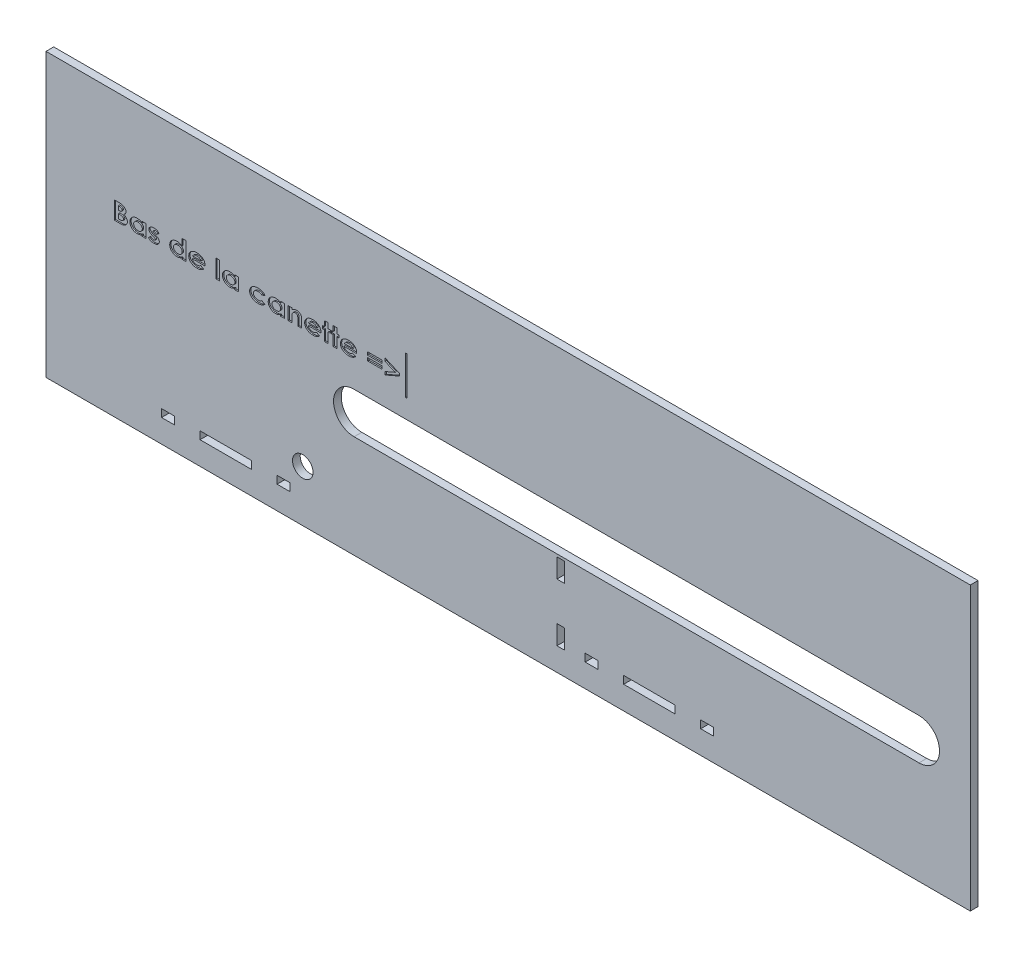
SolidWorks part; units mm, degrees
ref_plane "Plan de face" through (0, 0, 0) normal (0, 0, 1) x (1, 0, 0)
ref_plane "Plan de dessus" through (0, 0, 0) normal (0, 1, 0) x (1, 0, 0)
ref_plane "Plan de droite" through (0, 0, 0) normal (1, 0, 0) x (0, 0, -1)
sketch "Esquisse1" plane through (0, 0, 0) normal (0, 0, 1) x (1, 0, 0)
  line L0 (20, 28) -> (240, 28) construction
  line L1 (20, 36) -> (240, 36)
  line L2 (20, 20) -> (240, 20)
  line L4 (-100, -30) -> (260, -30)
  line L5 (-100, -30) -> (-100, 90)
  line L6 (-100, 90) -> (260, 90)
  line L7 (260, -30) -> (260, 90)
  circle A0 centre (0, 0) radius 4
  arc A1 (20, 36) -> (20, 20) centre (20, 28) ccw
  arc A2 (240, 20) -> (240, 36) centre (240, 28) ccw
  point P5 (130, 28)
  point P10 (130, 20)
  dimension "D1" = 8
  dimension "D2" = 16
  dimension "D3" = 220
  dimension "D4" = 20
  dimension "D5" = 28
  dimension "D6" = 100
  dimension "D7" = 30
  dimension "D8" = 120
  dimension "D9" = 360
extrude "Boss.-Extru.1" add sketch "Esquisse1" along normal blind 3
other "Empreinte1"
other "butee<1>@Assemblage11"
other "Empreinte2"
other "butee<2>@Assemblage11"
sketch "Esquisse2" plane through (0, 0, 3) normal (0, 0, 1) x (1, 0, 0)
  line L0 (40.28, 58.2901) -> (40.28, 43.2901)
  line L6 (260, -30) -> (260, 90) construction
  dimension "D1" = 219.72
  dimension "D2" = 15
extrude "Enlèv. de mat.-Extru.-Mince1" cut sketch "Esquisse2" against normal blind 1 and the other way through all thin
other "Empreinte3"
other "guide<1>@Assemblage11"
sketch "Esquisse3" plane through (0, 0, 3) normal (0, 0, 1) x (1, 0, 0)
  line L0 (-20.5623, 51.5712) -> (36.7637, 51.5712) construction
  text T0 "<b>Bas de la canette =></b>" font "Century Gothic" height in points 26
  point P3 (81.6207, 68.5133)
  point P4 (74.062, 71.9931)
  point P5 (7.7282, 69.9582)
  point P6 (36.7637, 53.8837)
  point P7 (-12.9085, 51.7083)
  point P8 (-24.9864, 52.3321)
  point P9 (-15.8664, 51.4903)
  point P10 (-20.5623, 51.5712)
extrude "Enlèv. mat.-Extru.1" cut sketch "Esquisse3" against normal blind 0.5
sketch "Esquisse4" plane through (0, -30, 0) normal (0, -1, 0) x (1, 0, 0)
  line L5 (-100, 0) -> (260, 0)
  line L6 (260, 0) -> (260, 3)
  line L7 (260, 3) -> (-100, 3)
  line L8 (-100, 3) -> (-100, 0)
  line L9 (-100, 0) -> (260, 0)
  line L10 (260, 0) -> (260, 3)
  line L11 (260, 3) -> (-100, 3)
  line L12 (-100, 3) -> (-100, 0)
  dimension "D1" = 0
extrude "Enlèv. mat.-Extru.2" cut sketch "Esquisse4" against normal blind 10
